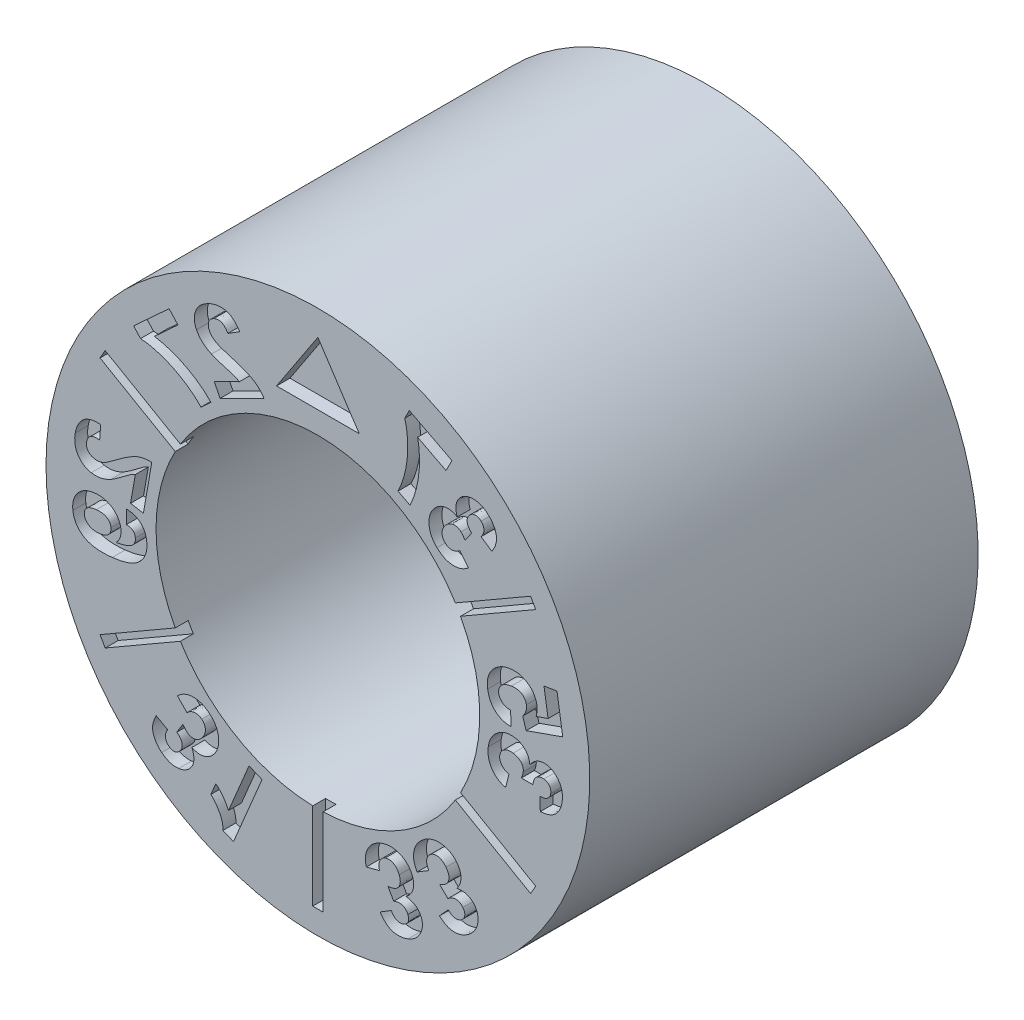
SolidWorks part; units mm, degrees
ref_plane "Front Plane" through (0, 0, 0) normal (0, 0, 1) x (1, 0, 0)
ref_plane "Top Plane" through (0, 0, 0) normal (0, 1, 0) x (1, 0, 0)
ref_plane "Right Plane" through (0, 0, 0) normal (1, 0, 0) x (0, 0, -1)
imported_body "Imported1"
other "DeleteFace1"
other "Move Face1" parameters "D1"=0.11
sketch "Sketch1" plane through (0, 0, 0) normal (0, 0, 1) x (1, 0, 0)
  line L0 (0, 0) -> (0, 2.2775) construction
  line L1 (0, 0) -> (1.1387, 1.9723) construction
  line L2 (0, 0) -> (1.9723, 1.1387) construction
  line L3 (0, 0) -> (2.2775, 0) construction
  line L4 (0, 0) -> (1.9723, -1.1387) construction
  line L5 (0, 0) -> (1.1387, -1.9723) construction
  line L6 (0, 0) -> (0, -2.2775) construction
  line L7 (0, 0) -> (-1.1387, -1.9723) construction
  line L8 (0, 0) -> (-1.9723, -1.1387) construction
  line L9 (0, 0) -> (-2.2775, 0) construction
  line L10 (0, 0) -> (-1.9723, 1.1387) construction
  line L11 (0, 0) -> (-1.1387, 1.9723) construction
  line L12 (-1.0592, -0.5654) -> (-1.0192, -0.6346)
  line L13 (-0.04, -1.2) -> (0.04, -1.2)
  line L14 (-0.04, -1.2) -> (-0.04, -1.92)
  line L15 (-0.04, -1.92) -> (0.04, -1.92)
  line L16 (0.04, -1.2) -> (0.04, -1.92)
  line L17 (-1.0192, -0.6346) -> (-1.6428, -0.9946)
  line L18 (-1.0592, -0.5654) -> (-1.6828, -0.9254)
  line L19 (-1.6828, -0.9254) -> (-1.6428, -0.9946)
  line L20 (-1.0192, 0.6346) -> (-1.0592, 0.5654)
  line L21 (-1.0592, 0.5654) -> (-1.6828, 0.9254)
  line L22 (-1.0192, 0.6346) -> (-1.6428, 0.9946)
  line L23 (-1.6428, 0.9946) -> (-1.6828, 0.9254)
  line L28 (1.0592, 0.5654) -> (1.0192, 0.6346)
  line L29 (1.0192, 0.6346) -> (1.6428, 0.9946)
  line L30 (1.0592, 0.5654) -> (1.6828, 0.9254)
  line L31 (1.6828, 0.9254) -> (1.6428, 0.9946)
  line L32 (1.0192, -0.6346) -> (1.0592, -0.5654)
  line L33 (1.0592, -0.5654) -> (1.6828, -0.9254)
  line L34 (1.0192, -0.6346) -> (1.6428, -0.9946)
  line L35 (1.6428, -0.9946) -> (1.6828, -0.9254)
  line L36 (0.04, 1.92) -> (-0.04, 1.92)
  line L37 (0.04, 1.2) -> (0.04, 1.92)
  line L38 (-0.04, 1.2) -> (-0.04, 1.92)
  line L39 (0.04, 1.2) -> (-0.04, 1.2)
  arc A0 (-0.3969, 1.2956) -> (0, 1.355) centre (0, 0) ccw construction
  text T0 "27   29    31    33    35   37" font "Arial" height 0.57
  point P18 (0, 0)
  point P44 (0, 0)
  dimension "D1" = 2.71
  dimension "D2" = 12
  dimension "D7" = 6
extrude "Cut-Extrude1" cut sketch "Sketch1" against normal blind 0.1
